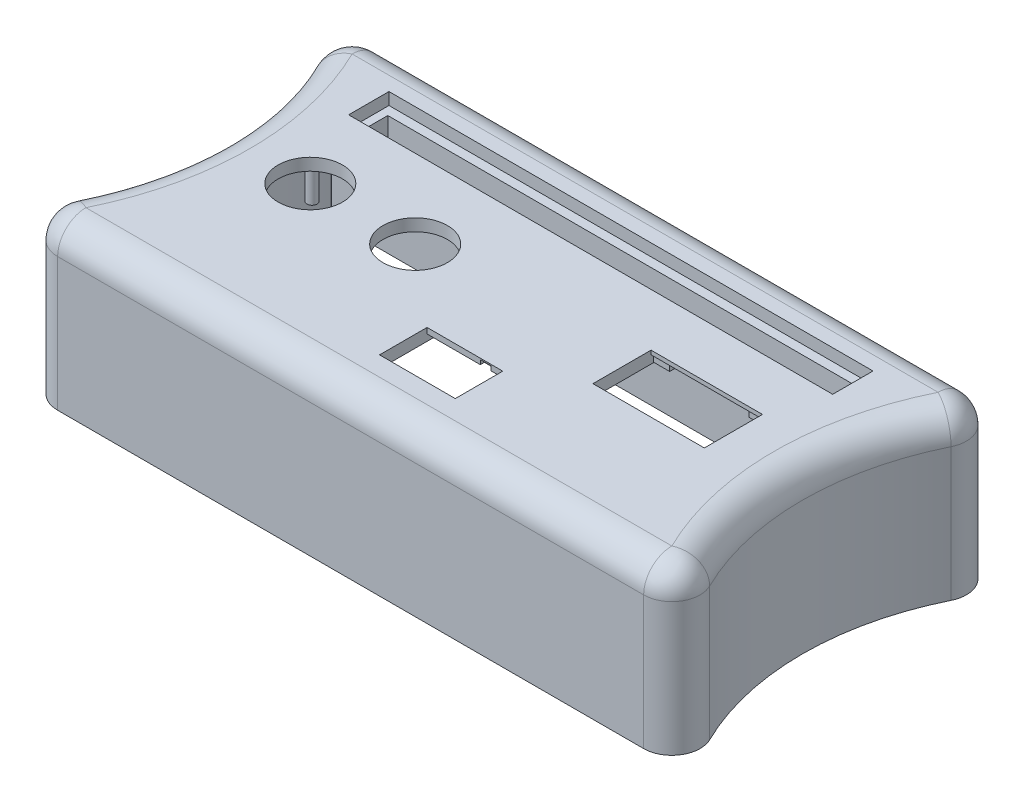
SolidWorks part; units mm, degrees
ref_plane "Alzado" through (0, 0, 0) normal (0, 0, 1) x (1, 0, 0)
ref_plane "Planta" through (0, 0, 0) normal (0, 1, 0) x (1, 0, 0)
ref_plane "Vista lateral" through (0, 0, 0) normal (1, 0, 0) x (0, 0, -1)
sketch "Croquis1" plane through (0, 0, 0) normal (0, 1, 0) x (1, 0, 0)
  line L4 (-85, -40) -> (85, -40)
  line L6 (-85, 40) -> (85, 40)
  line L8 (-85, -40) -> (85, 40) construction
  line L9 (-85, 40) -> (85, -40) construction
  arc A4 (-85, 40) -> (-85, -40) centre (-139.9199, 0) cw
  arc A5 (85, 40) -> (85, -40) centre (139.9199, 0) ccw
  point P0 (0, 0)
  dimension "D1" = 170
  dimension "D3" = 67.9426
  dimension "D2" = 80
extrude "Saliente-Extruir1" add sketch "Croquis1" along normal blind 40
fillet "Redondeo8" radius 7 4 edges at (71.9773, 40, 0) (0, 40, 40) (-71.9773, 40, 0) (0, 40, -40)
fillet "Redondeo9" radius 7 8 edges at (84.1714, 35.4013, -39.5752) (84.1714, 35.4013, 39.5752) (-84.1714, 35.4013, 39.5752) (-84.1714, 35.4013, -39.5752) (85, 16.5, -40) (85, 16.5, 40) (-85, 16.5, 40) (-85, 16.5, -40)
sketch "Croquis3" plane through (0, 40, 0) normal (0, 1, 0) x (1, 0, 0)
  line L0 (72.634, -40) -> (-72.634, -40) construction
  line L1 (-60, 29.5002) -> (60, 29.5002)
  line L2 (-60, 29.5002) -> (-60, 19.5002)
  line L3 (-60, 19.5002) -> (60, 19.5002)
  line L4 (60, 29.5002) -> (60, 19.5002)
  line L5 (28, 6.4692) -> (55.61, 6.4692)
  line L6 (28, 6.4692) -> (28, -7.9308)
  line L7 (28, -7.9308) -> (55.61, -7.9308)
  line L8 (55.61, 6.4692) -> (55.61, -7.9308)
  line L9 (-4.634, -13.82) -> (14.136, -13.82)
  line L10 (-4.634, -13.82) -> (-4.634, -28.2)
  line L11 (-4.634, -28.2) -> (14.136, -28.2)
  line L12 (14.136, -13.82) -> (14.136, -28.2)
  line L13 (-72.634, 40) -> (72.634, 40) construction
  line L15 (72.634, 33) -> (72.634, 40) construction
  circle A1 centre (-50, 0) radius 7.985
  circle A2 centre (-24, 0) radius 7.985
  arc A3 (-78.9188, -29.9176) -> (-72.634, -40) centre (-72.634, -33) ccw construction
  point P12 (-34.2299, 0)
  point P13 (0, 0)
  point P26 (28, -0.7308)
  dimension "D5" = 15.97
  dimension "D6" = 26
  dimension "D7" = 15.97
  dimension "D1" = 120
  dimension "D2" = 10
  dimension "D3" = 27.61
  dimension "D4" = 14.4
  dimension "D8" = 18.77
  dimension "D9" = 14.38
  dimension "D10" = 11.8
  dimension "D11" = 68
  dimension "D12" = 24
  dimension "D13" = 28
  dimension "D14" = 13.031
  dimension "D15" = 10.4998
  dimension "D16" = 12.634
shell "Vaciado1" thickness 3
extrude "Cortar-Extruir2" cut sketch "Croquis3" against normal through all
sketch "Croquis5" plane through (0, 37, 0) normal (0, -1, 0) x (1, 0, 0)
  circle A0 centre (-15.9726, 8.5003) radius 1.2633 construction
  circle A1 centre (-15.9726, 8.5003) radius 1.2633
  circle A2 centre (-16.016, -8.4959) radius 1.2633 construction
  circle A3 centre (-16.016, -8.4959) radius 1.2633
  circle A4 centre (-58.0095, -8.4357) radius 1.2633 construction
  circle A5 centre (-58.0095, -8.4357) radius 1.2633
  circle A6 centre (-57.98, 8.5792) radius 1.2633 construction
  circle A7 centre (-57.98, 8.5792) radius 1.2633
extrude "Saliente-Extruir2" add sketch "Croquis5" along normal up to vertex
sketch "Sketch1" plane through (0, 37, 0) normal (0, -1, 0) x (1, 0, 0)
  line L0 (28.155, -11.0892) -> (55.455, -11.0892) construction
  line L1 (28, -11.0892) -> (55.61, -11.0892)
  line L2 (48.805, 16.7108) -> (55.455, 16.7108) construction
  line L3 (28, 16.7108) -> (55.61, 16.7108)
  line L4 (28, -6.4692) -> (28, 7.9308) construction
  line L5 (28, -11.0892) -> (28, 16.7108)
  line L6 (55.61, 7.9308) -> (55.61, -6.4692) construction
  line L7 (55.61, 16.7108) -> (55.61, -11.0892)
extrude "Cut-Extrude1" cut sketch "Sketch1" against normal blind 2
sketch "Sketch2" plane through (0, 39, 0) normal (0, -1, 0) x (1, 0, 0)
  line L0 (55.61, -11.0892) -> (55.61, -6.4692) construction
  line L1 (28, -11.0892) -> (32, -11.0892)
  line L2 (28, -11.0892) -> (28, -7.0892)
  line L3 (28, -7.0892) -> (32, -7.0892)
  line L4 (32, -11.0892) -> (32, -7.0892)
  line L5 (28, 16.7108) -> (32, 16.7108)
  line L6 (28, 16.7108) -> (28, 12.7108)
  line L7 (28, 12.7108) -> (32, 12.7108)
  line L8 (32, 16.7108) -> (32, 12.7108)
  line L9 (55.61, 16.7108) -> (51.61, 16.7108)
  line L10 (55.61, 16.7108) -> (55.61, 12.7108)
  line L11 (55.61, 12.7108) -> (51.61, 12.7108)
  line L12 (51.61, 16.7108) -> (51.61, 12.7108)
  line L13 (55.61, -11.0892) -> (51.61, -11.0892)
  line L14 (55.61, -11.0892) -> (55.61, -7.0892)
  line L15 (55.61, -7.0892) -> (51.61, -7.0892)
  line L16 (51.61, -11.0892) -> (51.61, -7.0892)
  line L17 (55.61, 16.7108) -> (55.61, -11.0892) construction
  line L18 (28, -11.0892) -> (55.61, -11.0892) construction
  dimension "D1" = 4
  dimension "D2" = 4
extrude "Boss-Extrude2" add sketch "Sketch2" along normal up to surface (1.9 mm away)
sketch "Sketch3" plane through (0, 40, 0) normal (0, 1, 0) x (1, 0, 0)
  line L0 (14.136, -28.2) -> (14.136, -13.82) construction
  line L9 (-4.634, -13.82) -> (14.136, -13.82)
  line L10 (-4.634, -13.82) -> (-4.634, -16.42)
  line L11 (-4.634, -16.42) -> (14.136, -16.42)
  line L12 (14.136, -13.82) -> (14.136, -16.42)
  line L17 (14.136, -13.82) -> (-4.634, -13.82) construction
  point P5 (15.5574, -13.86)
  point P6 (14.136, -13.82)
  point P10 (11.5167, -16.3225)
  dimension "D2" = 2.6
extrude "Boss-Extrude3" add sketch "Sketch3" against normal up to surface (1.4 mm away)
sketch "Sketch4" plane through (0, 0, 16.42) normal (0, 0, 1) x (1, 0, 0)
  line L0 (-4.634, 38.6) -> (14.136, 38.6) construction
  line L1 (11.266, 38.6) -> (8.566, 38.6)
  line L2 (11.266, 38.6) -> (11.266, 39.7)
  line L3 (11.266, 39.7) -> (8.566, 39.7)
  line L4 (8.566, 38.6) -> (8.566, 39.7)
  line L5 (14.136, 38.6) -> (14.136, 40) construction
  point P6 (8.3801, 38.6)
  point P7 (11.35, 38.6)
  point P8 (8.5623, 38.6)
  point P9 (11.2644, 39.746)
  dimension "D1" = 2.87
  dimension "D2" = 2.7
  dimension "D3" = 1.1
extrude "Cut-Extrude2" cut sketch "Sketch4" against normal up to surface (2.6 mm away)
sketch "Sketch6" plane through (0, 37, 0) normal (0, -1, 0) x (1, 0, 0)
  line L0 (-72.634, -37) -> (72.634, -37) construction
  line L1 (-62.3818, -17.6) -> (62.0381, -17.6)
  line L2 (-62.3818, -17.6) -> (-62.3818, -31.6)
  line L3 (-62.3818, -31.6) -> (62.0381, -31.6)
  line L4 (62.0381, -17.6) -> (62.0381, -31.6)
  arc A0 (-72.634, -33) -> (-72.634, 33) centre (-139.9199, 0) ccw construction
  dimension "D1" = 124.42
  dimension "D2" = 14
  dimension "D3" = 5.4
  dimension "D4" = 77.538
extrude "Boss-Extrude4" add sketch "Sketch6" along normal blind 20
sketch "Sketch7" plane through (0, 37, 0) normal (0, 1, 0) x (1, 0, 0)
  line L1 (-58, 27.2002) -> (58, 27.2002)
  line L2 (-58, 27.2002) -> (-58, 21.8002)
  line L3 (-58, 21.8002) -> (58, 21.8002)
  line L4 (58, 27.2002) -> (58, 21.8002)
  line L6 (-60, 29.5002) -> (-60, 19.5002) construction
  line L7 (60, 29.5002) -> (-60, 29.5002) construction
  dimension "D1" = 116
  dimension "D2" = 5.4
  dimension "D3" = 2
  dimension "D4" = 2.3
extrude "Cut-Extrude3" cut sketch "Sketch7" against normal blind 10
